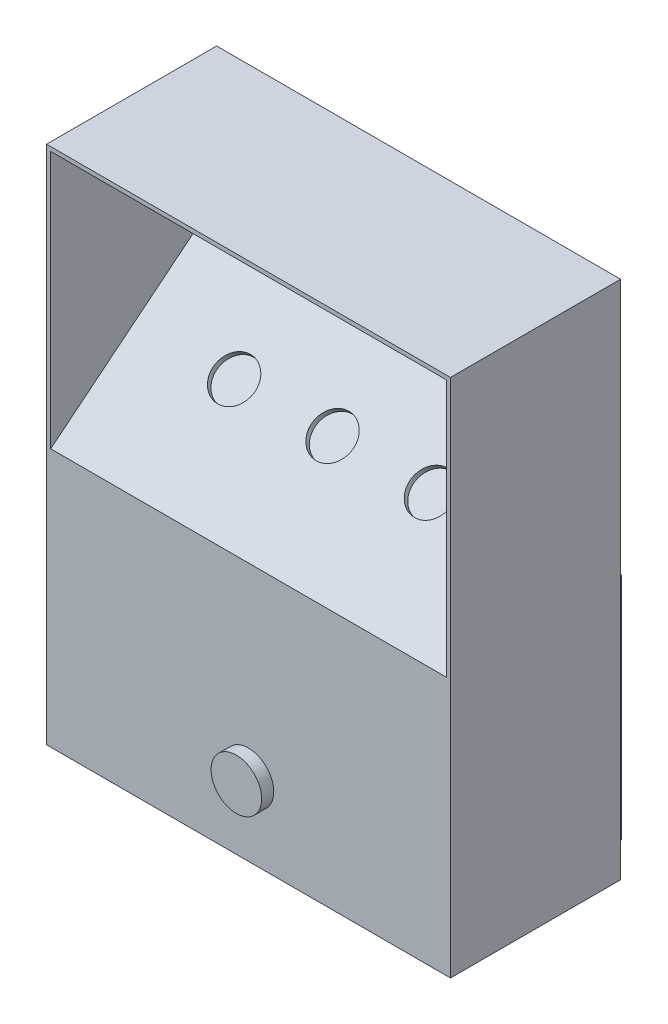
SolidWorks part; units mm, degrees
ref_plane "Front Plane" through (0, 0, 0) normal (0, 0, 1) x (1, 0, 0)
ref_plane "Top Plane" through (0, 0, 0) normal (0, 1, 0) x (1, 0, 0)
ref_plane "Right Plane" through (0, 0, 0) normal (1, 0, 0) x (0, 0, -1)
sketch "Sketch1" plane through (0, 0, 0) normal (0, 0, 1) x (1, 0, 0)
  line L0 (64.5973, 0) -> (-64.5973, 0) construction
  line L1 (-91.2368, 234.95) -> (91.2368, 234.95)
  line L2 (-91.2368, 234.95) -> (-91.2368, 0)
  line L3 (-91.2368, 0) -> (91.2368, 0)
  line L4 (91.2368, 234.95) -> (91.2368, 0)
  point P6 (0, 0)
  dimension "D1" = 234.95
  dimension "D2" = 182.4736
extrude "Boss-Extrude1" add sketch "Sketch1" along normal blind 76.835
sketch "Sketch2" plane through (0, 0, 0) normal (0, 0, -1) x (-1, 0, 0)
  line L0 (74.7123, 103.5558) -> (-74.7123, 103.5558) construction
  line L1 (-75.7809, 103.5558) -> (75.7809, 103.5558)
  line L2 (-75.7809, 103.5558) -> (-75.7809, 0)
  line L3 (-75.7809, 0) -> (75.7809, 0)
  line L4 (75.7809, 103.5558) -> (75.7809, 0)
  point P4 (0, 0)
  dimension "D2" = 151.5618
extrude "Boss-Extrude2" add sketch "Sketch2" along normal blind 15.8496
sketch "Sketch3" plane through (0, 0, 0) normal (1, 0, 0) x (0, 0, -1)
  line L0 (-76.835, 234.95) -> (-76.835, 0) construction
  line L1 (-0.9398, 233.0704) -> (-0.9398, 178.1861)
  line L2 (-0.9398, 178.1861) -> (-76.835, 116.7274)
  line L3 (-76.835, 116.7274) -> (-76.835, 233.0704)
  line L4 (-0.9398, 233.0704) -> (-76.835, 233.0704)
  line L5 (-76.835, 234.95) -> (0, 234.95) construction
  line L6 (0, 55) -> (0, -55) construction
  line L7 (-5.9615, 174.1196) -> (-75.211, 118.0425) construction
  dimension "D1" = 1.8796
  dimension "D2" = 0.9398
extrude "Cut-Extrude1" cut sketch "Sketch3" against normal mid plane 178.7144
sketch "Sketch4" plane through (0, 108.0762, 87.5184) normal (0, 0.7771, 0.6293) x (1, 0, 0)
  line L2 (0, 13.7469) -> (0, 111.4058) construction
  line L3 (-89.3572, 13.7469) -> (89.3572, 13.7469) construction
  line L4 (-89.3572, 111.4058) -> (89.3572, 111.4058) construction
  line L5 (-44.45, 62.5763) -> (0, 62.5763) construction
  line L6 (0, 62.5763) -> (44.45, 62.5763) construction
  circle A6 centre (-44.45, 62.5763) radius 9.525
  circle A7 centre (44.45, 62.5763) radius 9.525
  circle A8 centre (0, 62.5763) radius 9.525
  point P9 (0, 62.5763)
extrude "Cut-Extrude2" cut sketch "Sketch4" against normal blind 2.54
sketch "Sketch5" plane through (0, 0, -15.8496) normal (0, 0, -1) x (-1, 0, 0)
  line L0 (0, 94.9987) -> (0, 65.3302) construction
  line L1 (0, 55) -> (0, -55) construction
  circle A0 centre (57.15, 14.1224) radius 2.54 construction
  circle A1 centre (57.15, 90.3224) radius 2.54 construction
  circle A2 centre (57.15, 14.1224) radius 2.54
  circle A3 centre (57.15, 90.3224) radius 2.54
  circle A4 centre (-57.15, 90.3224) radius 2.54
  circle A5 centre (-57.15, 14.1224) radius 2.54
extrude "Cut-Extrude3" cut sketch "Sketch5" against normal blind 5.08
sketch "Sketch6" plane through (0, 0, 76.835) normal (0, 0, 1) x (1, 0, 0)
  circle A0 centre (-0.0238, 32.8921) radius 11.43 construction
  circle A1 centre (-0.0238, 32.8921) radius 11.43
extrude "Boss-Extrude3" add sketch "Sketch6" along normal up to vertex (5.4698 mm away)
